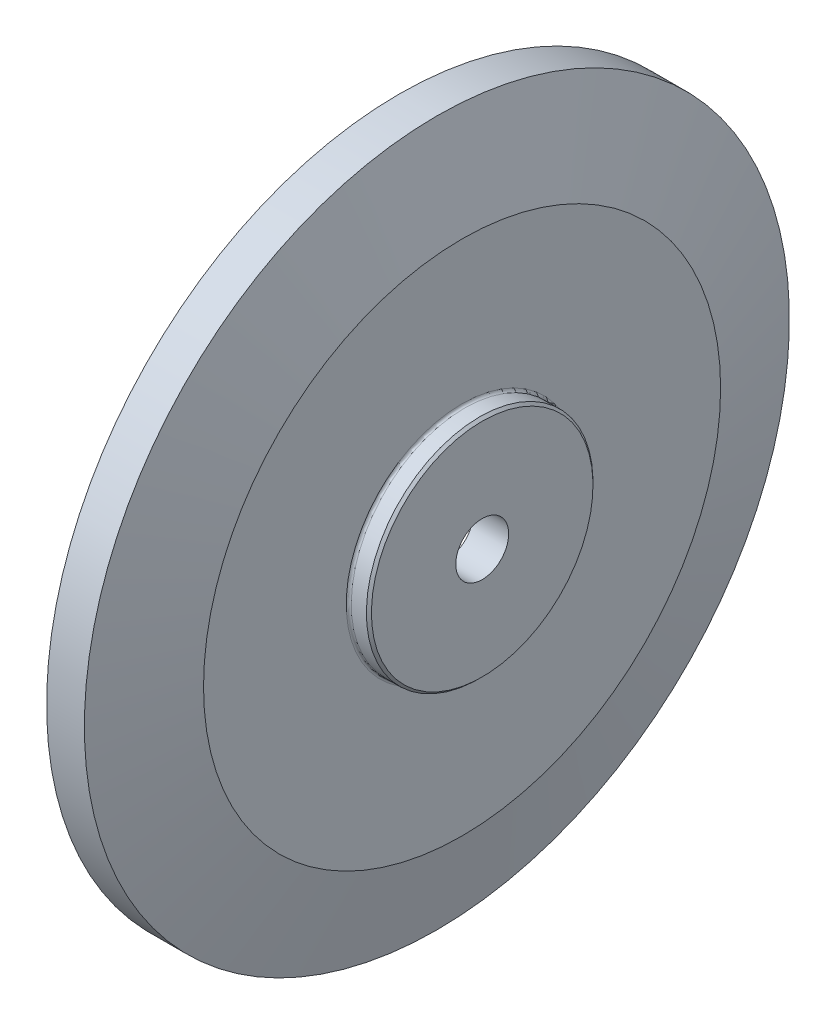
SolidWorks part; units mm, degrees
ref_plane "Płaszczyzna przednia" through (0, 0, 0) normal (0, 0, 1) x (1, 0, 0)
ref_plane "Płaszczyzna górna" through (0, 0, 0) normal (0, 1, 0) x (1, 0, 0)
ref_plane "Płaszczyzna prawa" through (0, 0, 0) normal (1, 0, 0) x (0, 0, -1)
sketch "Szkic1" plane through (0, 0, 0) normal (0, 0, 1) x (1, 0, 0)
  line L0 (0, 0) -> (-73.0668, 0) construction
  line L1 (-31.2472, 140) -> (-31.2472, 100)
  line L2 (-31.2472, 100) -> (-24.2472, 100)
  line L3 (-24.2472, 100) -> (-24.2472, 0)
  line L4 (-24.2472, 0) -> (1.7528, 0)
  line L5 (1.7528, 0) -> (1.7528, 45)
  line L6 (1.7528, 45) -> (-6.2472, 45)
  line L7 (-6.2472, 45) -> (-6.2472, 140)
  line L8 (-6.2472, 140) -> (-31.2472, 140)
  dimension "D1" = 280
  dimension "D2" = 200
  dimension "D3" = 90
  dimension "D4" = 7
  dimension "D5" = 25
  dimension "D6" = 33
revolve "Obrót1" add sketch "Szkic1" angle 360 about L0
chamfer "Sfazowanie2" distance 10 angle 75 1 edges at (-6.2472, 140, 0)
chamfer "Sfazowanie3" distance 5 angle 45 1 edges at (-24.2472, 100, 0)
fillet "Zaokrąglenie1" radius 1 1 edges at (-6.2472, 45, 0)
chamfer "Sfazowanie4" distance 1 angle 45 1 edges at (1.7528, 45, 0)
sketch "Szkic2" plane through (-24.2472, 0, 0) normal (-1, 0, 0) x (0, 0, 1)
  circle A0 centre (0, 0) radius 30
  dimension "D1" = 60
extrude "Wytnij-wyciągnięcie1" cut sketch "Szkic2" against normal blind 12
hole_wizard "Otwór pod śrubę M201" positions "Szkic4" profile "Szkic3" hole size "M20" standard "ISO"
sketch "Szkic4" plane through (-12.2472, 0, 0) normal (-1, 0, 0) x (0, 0, 1)
  circle A0 centre (0, 0) radius 30 construction
  point P0 (0, 0)
sketch "Szkic3" plane through (-12.2472, 0, 0) normal (0, 1, 0) x (0, 0, 1)
  line L0 (0, 0) -> (0, 14)
  line L1 (0, 14) -> (10.5, 14)
  line L2 (10.5, 14) -> (10.5, 0)
  line L5 (10.5, 0) -> (0, 0)
  line L11 (0, -6.35) -> (0, 107.95) construction
  dimension "Średnica otworu na wylot" = 21
  dimension "Głębokość otworu na wylot" = 14
